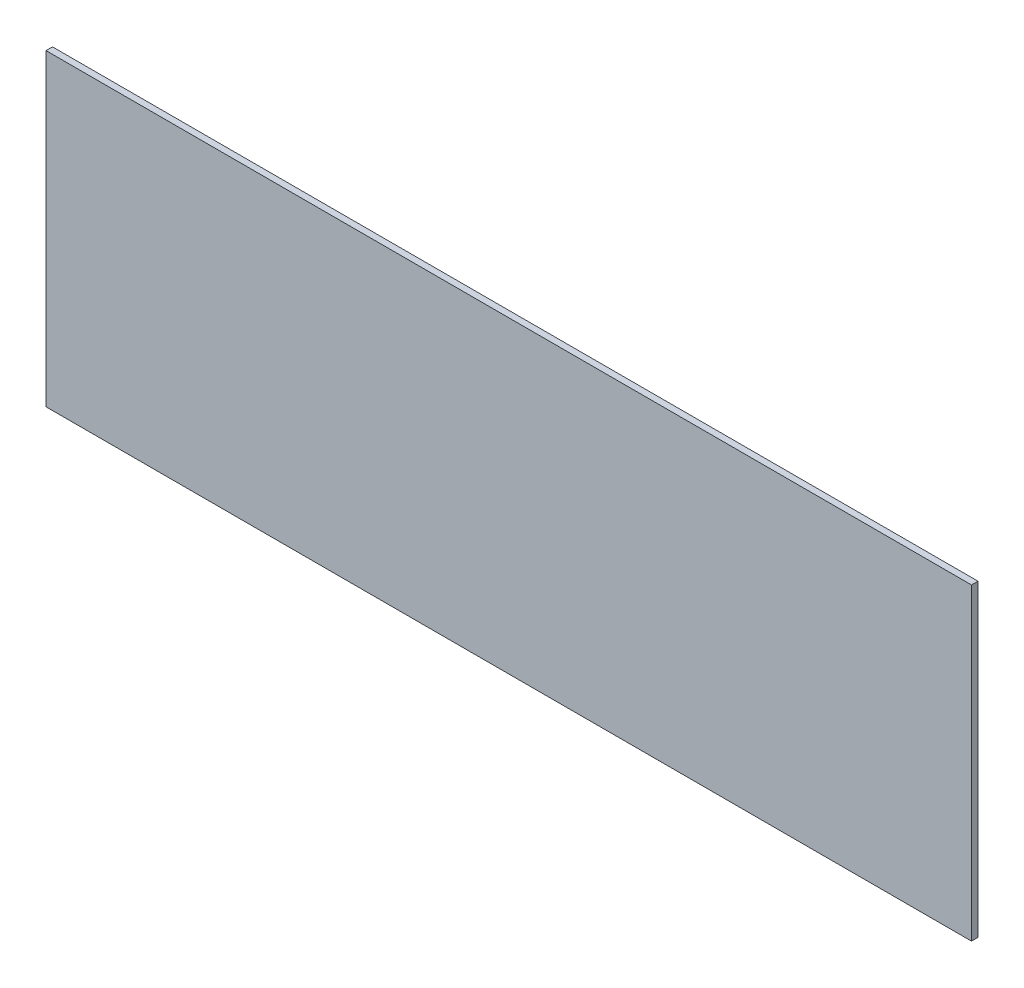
SolidWorks part; units mm, degrees
ref_plane "Front Plane" through (0, 0, 0) normal (0, 0, 1) x (1, 0, 0)
ref_plane "Top Plane" through (0, 0, 0) normal (0, 1, 0) x (1, 0, 0)
ref_plane "Right Plane" through (0, 0, 0) normal (1, 0, 0) x (0, 0, -1)
sketch "Sketch1" plane through (0, 0, 0) normal (0, 0, 1) x (1, 0, 0)
  line L1 (0, 0) -> (228.6, 0)
  line L2 (0, 0) -> (0, 76.2)
  line L3 (0, 76.2) -> (228.6, 76.2)
  line L4 (228.6, 0) -> (228.6, 76.2)
  dimension "D1" = 228.6
  dimension "D2" = 76.2
extrude "Extrude1" add sketch "Sketch1" along normal blind 1.6002
